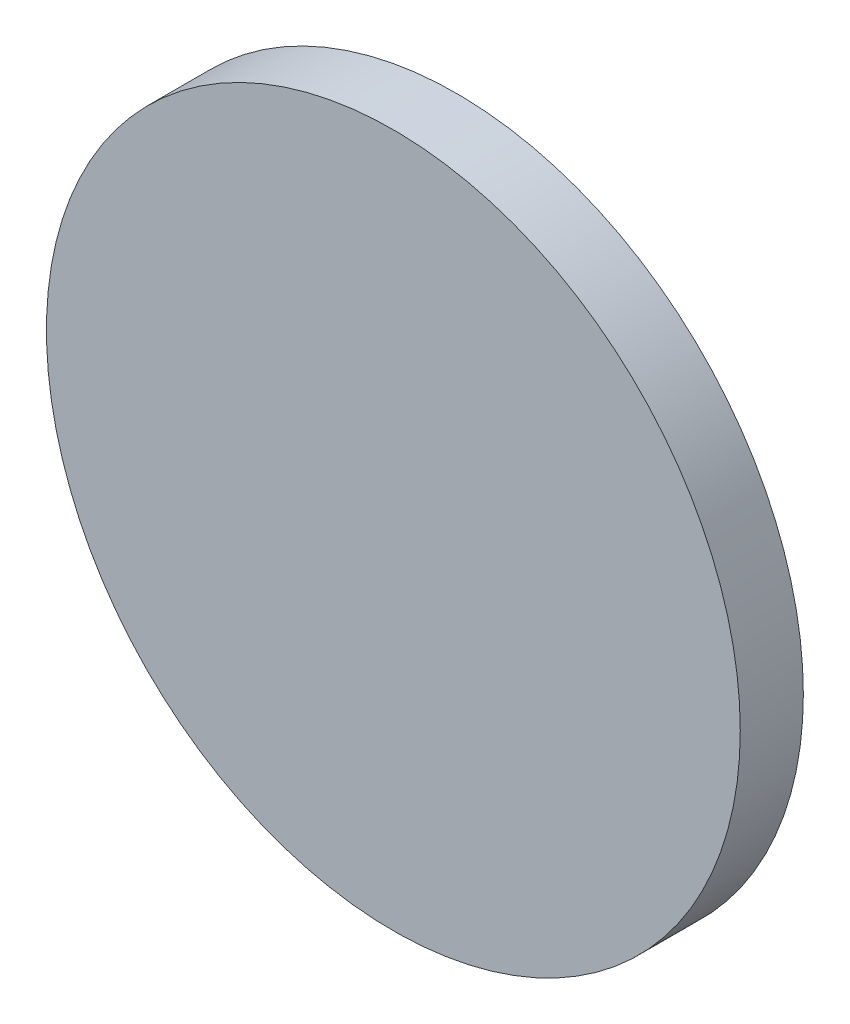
SolidWorks part; units mm, degrees
ref_plane "Front Plane" through (0, 0, 0) normal (0, 0, 1) x (1, 0, 0)
ref_plane "Top Plane" through (0, 0, 0) normal (0, 1, 0) x (1, 0, 0)
ref_plane "Right Plane" through (0, 0, 0) normal (1, 0, 0) x (0, 0, -1)
sketch "Sketch1" plane through (0, 0, 0) normal (0, 0, 1) x (1, 0, 0)
  circle A0 centre (0, 0) radius 5
  dimension "D1" = 10
extrude "Boss-Extrude1" add sketch "Sketch1" along normal blind 12
sketch "Sketch2" plane through (0, 0, 12) normal (0, 0, 1) x (1, 0, 0)
  circle A0 centre (0, 0) radius 55
  dimension "D1" = 110
extrude "Boss-Extrude2" add sketch "Sketch2" along normal blind 10
